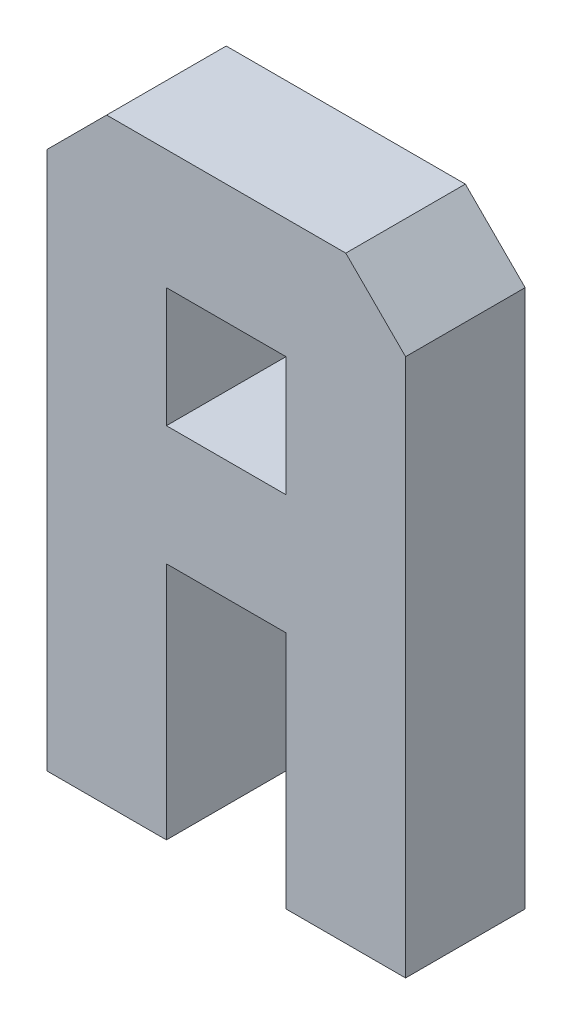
SolidWorks part; units mm, degrees
ref_plane "Plan de face" through (0, 0, 0) normal (0, 0, 1) x (1, 0, 0)
ref_plane "Plan de dessus" through (0, 0, 0) normal (0, 1, 0) x (1, 0, 0)
ref_plane "Plan de droite" through (0, 0, 0) normal (1, 0, 0) x (0, 0, -1)
sketch "Esquisse1" plane through (0, 0, 0) normal (0, 0, 1) x (1, 0, 0)
  line L0 (0, 0) -> (0, 50)
  line L1 (0, 50) -> (30, 50)
  line L2 (30, 50) -> (30, 0)
  line L3 (30, 0) -> (20, 0)
  line L4 (20, 0) -> (20, 20)
  line L5 (20, 20) -> (10, 20)
  line L6 (10, 20) -> (10, 0)
  line L7 (10, 0) -> (0, 0)
  line L9 (10, 40) -> (20, 40)
  line L10 (10, 40) -> (10, 30)
  line L11 (10, 30) -> (20, 30)
  line L12 (20, 40) -> (20, 30)
  dimension "D1" = 10
  dimension "D2" = 10
  dimension "D3" = 10
  dimension "D4" = 20
  dimension "D5" = 10
  dimension "D6" = 10
  dimension "D7" = 10
  dimension "D8" = 10
  dimension "D9" = 10
extrude "Boss.-Extru.1" add sketch "Esquisse1" along normal blind 10
chamfer "Chanfrein1" distance 5 angle 45 2 edges at (0, 50, 5) (30, 50, 5)
